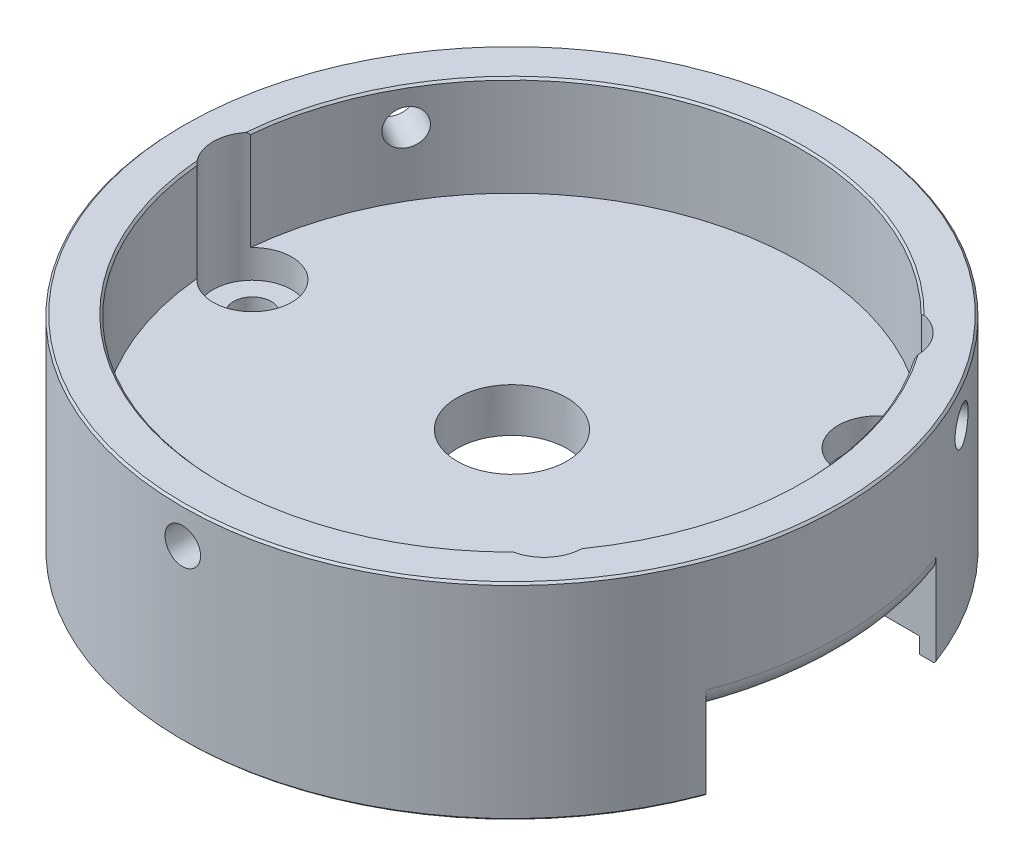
SolidWorks part; units mm, degrees
ref_plane "Front Plane" through (0, 0, 0) normal (0, 0, 1) x (1, 0, 0)
ref_plane "Top Plane" through (0, 0, 0) normal (0, 1, 0) x (1, 0, 0)
ref_plane "Right Plane" through (0, 0, 0) normal (1, 0, 0) x (0, 0, -1)
sketch "Sketch1" plane through (0, 0, 0) normal (0, 1, 0) x (1, 0, 0)
  circle A0 centre (0, 0) radius 20.955
  dimension "D1" = 41.91
extrude "Extrude1" add sketch "Sketch1" along normal blind 17.78
sketch "Sketch2" plane through (0, 0, 0) normal (0, -1, 0) x (1, 0, 0)
  circle A0 centre (0, 0) radius 17.272
  dimension "D1" = 34.544
extrude "Outside Lower Relief" cut sketch "Sketch2" against normal blind 4.699 flip side to cut
sketch "Sketch3" plane through (0, 17.78, 0) normal (0, 1, 0) x (-1, 0, 0)
  circle A0 centre (0, 0) radius 18.4023
  dimension "D1" = 36.8046
extrude "Resolver Bore" cut sketch "Sketch3" against normal blind 6.35
sketch "Sketch4" plane through (0, 11.43, 0) normal (0, 1, 0) x (-1, 0, 0)
  circle A0 centre (0, 0) radius 3.4925
  dimension "D1" = 6.985
extrude "Shaft Hole" cut sketch "Sketch4" against normal through all
sketch "Sketch5" plane through (0, 0, 0) normal (0, -1, 0) x (1, 0, 0)
  circle A0 centre (0, 0) radius 15.875
  dimension "D1" = 31.75
extrude "Inside lower relief" cut sketch "Sketch5" against normal blind 6.858
sketch "Sketch8" plane through (0, 0, 0) normal (0, -1, 0) x (1, 0, 0)
  line L0 (19.6414, 7.3025) -> (14.3967, 7.3025)
  line L1 (19.6414, -7.3025) -> (14.3967, -7.3025)
  arc A0 (14.3967, 7.3025) -> (14.3967, -7.3025) centre (14.3967, 0) ccw
  circle A2 centre (0, 0) radius 20.955 construction
  arc A3 (19.6414, -7.3025) -> (19.6414, 7.3025) centre (0, 0) ccw
  dimension "D1" = 14.605
  dimension "D2" = 14.3967
extrude "Wire relief" cut sketch "Sketch8" against normal blind 9.271
hole_wizard "Counter bore for motor screws" positions "Sketch10" profile "Sketch9" counterbore size "M2" standard "Ansi Metric"
sketch "Sketch10" plane through (0, 11.43, 0) normal (0, 1, 0) x (-1, 0, 0)
  line L0 (0, 0) -> (-14.2222, 0) construction
  line L1 (0, 0) -> (-12.6397, 10.606) construction
  line L2 (0, 0) -> (-12.6397, -10.606) construction
  circle A0 centre (0, 0) radius 16.5 construction
  point P0 (-12.6397, 10.606)
  point P1 (-12.6397, -10.606)
  point P2 (16.5, 0)
  dimension "D1" = 33
  dimension "D2" = 80
sketch "Sketch9" plane through (12.6397, 11.43, 10.606) normal (1, 0, 0) x (0, 0, 1)
  line L0 (0, 0) -> (0, 11.43)
  line L1 (0, 11.43) -> (1.2, 11.43)
  line L3 (1.2, 11.43) -> (1.2, 1.8)
  line L4 (1.2, 1.8) -> (2.5, 1.8)
  line L5 (2.5, 1.8) -> (2.5, 0)
  line L7 (2.5, 0) -> (0, 0)
  line L11 (0, -6.35) -> (0, 107.95) construction
  dimension "Thru Hole Dia." = 2.4
  dimension "Thru Hole Depth" = 11.43
  dimension "C'Bore Dia." = 5
  dimension "C'Bore Depth" = 1.8
chamfer ".05 chamfer" distance 0.127 angle 45 7 edges at (0, 17.78, 18.4023) (0, 17.78, 20.955) (-5.9074, 0, 16.2304) (-20.955, 4.699, 0) (14.8133, 0, 8.8819) (14.8133, 0, -8.8819) (-5.9074, 0, -16.2304)
fillet "fillet for wire relief" radius 1.27 1 edges at (20.955, 9.271, 0)
hole_wizard "#4-40 Tapped Hole1" positions "3DSketch2" profile "Sketch12" tap size "#4-40" standard "Ansi Inch"
sketch3d "3DSketch2"
  point P0 (0, 15.494, 20.955)
sketch "Sketch12" plane through (0, 15.494, 20.955) normal (1, 0, 0) x (0, -1, 0)
  line L0 (0, 0) -> (0, 8.2738)
  line L1 (0, 8.2738) -> (1.1303, 7.5946)
  line L2 (1.1303, 7.5946) -> (1.1303, 0)
  line L5 (1.1303, 0) -> (0, 0)
  line L10 (0, 8.2738) -> (-1.1303, 7.5946) construction
  line L11 (0, -6.35) -> (0, 107.95) construction
  dimension "Tap Drill Dia." = 2.2606
  dimension "Tap Drill Depth" = 7.5946
  dimension "Drill Angle" = 118
pattern_circular "CirPattern1" count 3 over 360 about axis through (0, 4.699, 0) along (0, -1, 0) of "#4-40 Tapped Hole1"
sketch "Sketch13" plane through (0, 17.78, 0) normal (0, 1, 0) x (-1, 0, 0)
  circle A0 centre (-12.6397, -10.606) radius 2.5
  circle A1 centre (-12.6397, 10.606) radius 2.5
  circle A2 centre (16.5, 0) radius 2.5
  arc A3 (18.3226, 1.7112) -> (18.3226, -1.7112) centre (16.5, 0) ccw construction
  arc A4 (-12.936, -13.0884) -> (-15.1358, -10.4667) centre (-12.6397, -10.606) ccw construction
  arc A5 (-15.1358, 10.4667) -> (-12.936, 13.0884) centre (-12.6397, 10.606) ccw construction
extrude "Cut-Extrude1" cut sketch "Sketch13" against normal up to next
sketch "Sketch14" plane through (0, 0, 0) normal (0, -1, 0) x (1, 0, 0)
  circle A0 centre (0, 0) radius 19.9771
  dimension "D1" = 39.9542
extrude "Cut-Extrude2" cut sketch "Sketch14" against normal blind 5.715
sketch "Sketch15" plane through (0, 6.858, 0) normal (0, -1, 0) x (1, 0, 0)
  circle A0 centre (0, 0) radius 11.43
  dimension "D1" = 22.86
extrude "Cut-Extrude3" cut sketch "Sketch15" against normal blind 1.778
